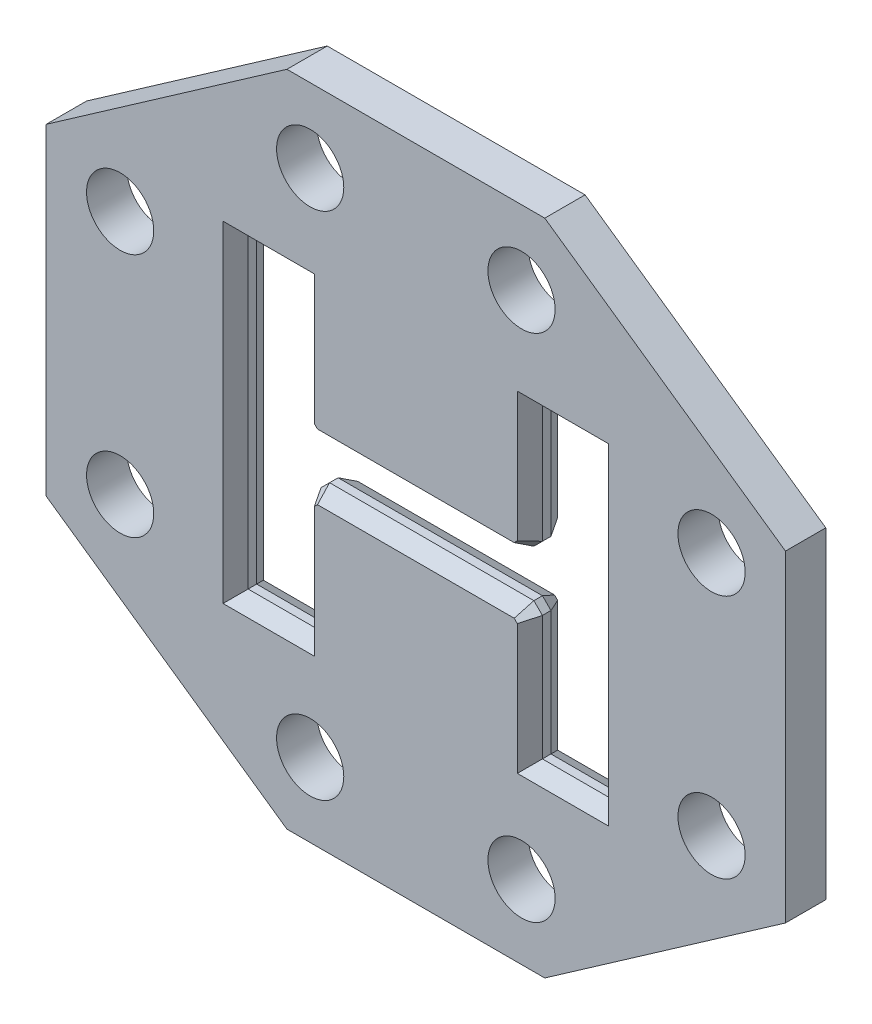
SolidWorks part; units mm, degrees
ref_plane "Front Plane" through (0, 0, 0) normal (1, 0, 0) x (0, 1, 0)
ref_plane "Top Plane" through (0, 0, 0) normal (0, 0, 1) x (0, 1, 0)
ref_plane "Right Plane" through (0, 0, 0) normal (0, 1, 0) x (-1, 0, 0)
sketch "sk W14x730" plane through (0, 0, 0) normal (0, 0, 1) x (0, 1, 0)
  point P0 (0, -284.734)
  point P1 (-38.989, 0)
  line B0 (-227.203, -284.734) -> (-227.203, -160.02)
  line B1 (-227.203, -160.02) -> (-54.229, -160.02)
  line B2 (-38.989, -144.78) -> (-38.989, 144.78)
  line B3 (-54.229, 160.02) -> (-227.203, 160.02)
  line B4 (-227.203, 160.02) -> (-227.203, 284.734)
  line B5 (-227.203, 284.734) -> (227.203, 284.734)
  line B6 (227.203, 284.734) -> (227.203, 160.02)
  line B7 (227.203, 160.02) -> (54.229, 160.02)
  line B8 (38.989, 144.78) -> (38.989, -144.78)
  line B9 (54.229, -160.02) -> (227.203, -160.02)
  line B10 (227.203, -160.02) -> (227.203, -284.734)
  line B11 (227.203, -284.734) -> (-227.203, -284.734)
  arc B12 (-54.229, -160.02) -> (-38.989, -144.78) centre (-54.229, -144.78) ccw
  arc B13 (-38.989, 144.78) -> (-54.229, 160.02) centre (-54.229, 144.78) ccw
  arc B14 (54.229, 160.02) -> (38.989, 144.78) centre (54.229, 144.78) ccw
  arc B15 (38.989, -144.78) -> (54.229, -160.02) centre (54.229, -144.78) ccw
sketch_block_instance "W14x730-113"
sketch_block "W14x730" parameters "D4"=15.24, "D1"=454.406, "D2"=569.468, "D3"=77.978, "D5"=124.714
sketch_block_instance "W14x730-232"
sketch_block_instance "W14x730-233"
sketch_block_instance "W14x730-234"
sketch_block_instance "W14x730-276"
sketch_block_instance "W14x730-277"
sketch_block_instance "W14x730-278"
sketch_block_instance "W14x730-279"
sketch_block_instance "W14x730-280"
sketch_block_instance "W14x730-281"
sketch_block_instance "W14x730-282"
sketch_block_instance "W14x730-283"
sketch_block_instance "W14x730-284"
sketch_block_instance "W14x730-285"
sketch_block_instance "W14x730-286"
sketch_block_instance "W14x730-287"
sketch_block_instance "W14x730-288"
sketch_block_instance "W14x730-289"
sketch_block_instance "W14x730-321"
sketch_block_instance "W14x730-322"
sketch_block_instance "W14x730-323"
sketch_block_instance "W14x730-324"
sketch_block_instance "W14x730-325"
sketch_block_instance "W14x730-326"
sketch_block_instance "W14x730-327"
sketch_block_instance "W14x730-328"
sketch_block_instance "W14x730-329"
sketch_block_instance "W14x730-330"
sketch_block_instance "W14x730-331"
sketch_block_instance "W14x730-332"
sketch_block_instance "W14x730-333"
sketch_block_instance "W14x730-334"
sketch_block_instance "W14x730-335"
sketch_block_instance "W14x730-336"
sketch_block_instance "W14x730-337"
sketch_block_instance "W14x730-338"
sketch_block_instance "W14x730-339"
sketch_block_instance "W14x730-340"
sketch_block_instance "W14x730-341"
sketch_block_instance "W14x730-365"
sketch_block_instance "W14x730-366"
sketch_block_instance "W14x730-367"
sketch_block_instance "W14x730-368"
sketch_block_instance "W14x730-369"
sketch_block_instance "W14x730-370"
sketch_block_instance "W14x730-371"
sketch_block_instance "W14x730-372"
sketch_block_instance "W14x730-373"
sketch_block_instance "W14x730-374"
sketch_block_instance "W14x730-375"
sketch_block_instance "W14x730-376"
sketch_block_instance "W14x730-377"
sketch_block_instance "W14x730-378"
sketch_block_instance "W14x730-379"
sketch_block_instance "W14x730-380"
sketch_block_instance "W14x730-381"
sketch_block_instance "W14x730-382"
sketch_block_instance "W14x730-383"
sketch_block_instance "W14x730-384"
sketch_block_instance "W14x730-385"
sketch_block_instance "W14x730-386"
sketch_block_instance "W14x730-387"
sketch_block_instance "W14x730-388"
sketch_block_instance "W14x730-389"
sketch_block_instance "W14x730-390"
sketch_block_instance "W14x730-391"
sketch_block_instance "W14x730-410"
sketch_block_instance "W14x730-411"
sketch_block_instance "W14x730-412"
sketch_block_instance "W14x730-413"
sketch_block_instance "W14x730-414"
sketch_block_instance "W14x730-415"
sketch_block_instance "W14x730-416"
sketch_block_instance "W14x730-417"
sketch_block_instance "W14x730-418"
sketch_block_instance "W14x730-419"
sketch_block_instance "W14x730-420"
sketch_block_instance "W14x730-421"
sketch_block_instance "W14x730-422"
sketch_block_instance "W14x730-423"
sketch_block_instance "W14x730-424"
sketch_block_instance "W14x730-425"
sketch_block_instance "W14x730-426"
sketch_block_instance "W14x730-427"
sketch_block_instance "W14x730-428"
sketch_block_instance "W14x730-429"
sketch_block_instance "W14x730-430"
sketch_block_instance "W14x730-431"
sketch_block_instance "W14x730-432"
sketch_block_instance "W14x730-433"
sketch_block_instance "W14x730-434"
sketch_block_instance "W14x730-435"
sketch_block_instance "W14x730-436"
sketch_block_instance "W14x730-437"
sketch_block_instance "W14x730-438"
sketch_block_instance "W14x730-439"
sketch_block_instance "W14x730-440"
sketch_block_instance "W14x730-443"
sketch_block_instance "W14x730-454"
sketch_block_instance "W14x730-455"
sketch_block_instance "W14x730-456"
sketch_block_instance "W14x730-457"
sketch_block_instance "W14x730-458"
sketch_block_instance "W14x730-459"
sketch_block_instance "W14x730-460"
sketch_block_instance "W14x730-461"
sketch_block_instance "W14x730-462"
sketch_block_instance "W14x730-463"
sketch_block_instance "W14x730-464"
sketch_block_instance "W14x730-465"
sketch_block_instance "W14x730-466"
sketch_block_instance "W14x730-467"
sketch_block_instance "W14x730-468"
sketch_block_instance "W14x730-469"
sketch_block_instance "W14x730-470"
sketch_block_instance "W14x730-471"
sketch_block_instance "W14x730-472"
sketch_block_instance "W14x730-473"
sketch_block_instance "W14x730-474"
sketch_block_instance "W14x730-475"
sketch_block_instance "W14x730-476"
sketch_block_instance "W14x730-477"
sketch_block_instance "W14x730-478"
sketch_block_instance "W14x730-479"
sketch_block_instance "W14x730-480"
sketch_block_instance "W14x730-481"
sketch_block_instance "W14x730-482"
sketch_block_instance "W14x730-483"
sketch_block_instance "W14x730-484"
sketch_block_instance "W14x730-485"
sketch_block_instance "W14x730-486"
sketch_block_instance "W14x730-487"
sketch_block_instance "W14x730-488"
sketch_block_instance "W14x730-489"
sketch_block_instance "W14x730-490" parameters "D1"=817.9177, "D2"=1027.7361, "D3"=0.4058, "D4"=24.0009, "D5"=0.4058, "D6"=533.4, "D7"=27.3509, "D8"=8374.3758, "D9"=3499.6788, "D10"=18059.4
sketch "sk W14x665" plane through (0, 0, 0) normal (0, 0, 1) x (0, 1, 0)
  point P0 (-224.155, -274.828)
  line B0 (-224.155, -274.828) -> (-224.155, -160.02)
  line B1 (-224.155, -160.02) -> (-51.181, -160.02)
  line B2 (-35.941, -144.78) -> (-35.941, 144.78)
  line B3 (-51.181, 160.02) -> (-224.155, 160.02)
  line B4 (-224.155, 160.02) -> (-224.155, 274.828)
  line B5 (-224.155, 274.828) -> (224.155, 274.828)
  line B6 (224.155, 274.828) -> (224.155, 160.02)
  line B7 (224.155, 160.02) -> (51.181, 160.02)
  line B8 (35.941, 144.78) -> (35.941, -144.78)
  line B9 (51.181, -160.02) -> (224.155, -160.02)
  line B10 (224.155, -160.02) -> (224.155, -274.828)
  line B11 (224.155, -274.828) -> (-224.155, -274.828)
  arc B12 (-51.181, -160.02) -> (-35.941, -144.78) centre (-51.181, -144.78) ccw
  arc B13 (-35.941, 144.78) -> (-51.181, 160.02) centre (-51.181, 144.78) ccw
  arc B14 (51.181, 160.02) -> (35.941, 144.78) centre (51.181, 144.78) ccw
  arc B15 (35.941, -144.78) -> (51.181, -160.02) centre (51.181, -144.78) ccw
sketch_block_instance "W14x665-1"
sketch_block "W14x665" parameters "D4"=15.24, "D1"=448.31, "D2"=549.656, "D3"=71.882, "D5"=114.808, "D6"=6.35
sketch "sk 605" plane through (0, 0, 0) normal (0, 0, 1) x (0, 1, 0)
  point P0 (-221.1705, -265.684)
  line B0 (-221.1705, -265.684) -> (-221.1705, -160.02)
  line B1 (-221.1705, -160.02) -> (-48.1965, -160.02)
  line B2 (-32.9565, -144.78) -> (-32.9565, 144.78)
  line B3 (-48.1965, 160.02) -> (-221.1705, 160.02)
  line B4 (-221.1705, 160.02) -> (-221.1705, 265.684)
  line B5 (-221.1705, 265.684) -> (221.1705, 265.684)
  line B6 (221.1705, 265.684) -> (221.1705, 160.02)
  line B7 (221.1705, 160.02) -> (48.1965, 160.02)
  line B8 (32.9565, 144.78) -> (32.9565, -144.78)
  line B9 (48.1965, -160.02) -> (221.1705, -160.02)
  line B10 (221.1705, -160.02) -> (221.1705, -265.684)
  line B11 (221.1705, -265.684) -> (-221.1705, -265.684)
  arc B12 (-48.1965, -160.02) -> (-32.9565, -144.78) centre (-48.1965, -144.78) ccw
  arc B13 (-32.9565, 144.78) -> (-48.1965, 160.02) centre (-48.1965, 144.78) ccw
  arc B14 (48.1965, 160.02) -> (32.9565, 144.78) centre (48.1965, 144.78) ccw
  arc B15 (32.9565, -144.78) -> (48.1965, -160.02) centre (48.1965, -144.78) ccw
sketch_block_instance "w14x605-2"
sketch_block "w14x605" parameters "D4"=15.24, "D1"=442.341, "D2"=531.368, "D3"=65.913, "D5"=105.664, "D6"=6.35
sketch "sk 550" plane through (0, 0, 0) normal (0, 0, 1) x (0, 1, 0)
  point P0 (-218.44, -257.048)
  point P1 (0, -257.048)
  point P2 (-30.226, 0)
  line B0 (-218.44, -257.048) -> (-218.44, -160.02)
  line B1 (-218.44, -160.02) -> (-45.466, -160.02)
  line B2 (-30.226, -144.78) -> (-30.226, 144.78)
  line B3 (-45.466, 160.02) -> (-218.44, 160.02)
  line B4 (-218.44, 160.02) -> (-218.44, 257.048)
  line B5 (-218.44, 257.048) -> (218.44, 257.048)
  line B6 (218.44, 257.048) -> (218.44, 160.02)
  line B7 (218.44, 160.02) -> (45.466, 160.02)
  line B8 (30.226, 144.78) -> (30.226, -144.78)
  line B9 (45.466, -160.02) -> (218.44, -160.02)
  line B10 (218.44, -160.02) -> (218.44, -257.048)
  line B11 (218.44, -257.048) -> (-218.44, -257.048)
  arc B12 (-45.466, -160.02) -> (-30.226, -144.78) centre (-45.466, -144.78) ccw
  arc B13 (-30.226, 144.78) -> (-45.466, 160.02) centre (-45.466, 144.78) ccw
  arc B14 (45.466, 160.02) -> (30.226, 144.78) centre (45.466, 144.78) ccw
  arc B15 (30.226, -144.78) -> (45.466, -160.02) centre (45.466, -144.78) ccw
sketch_block_instance "w14x550-1"
sketch_block "w14x550" parameters "D4"=15.24, "D1"=436.88, "D2"=514.096, "D3"=60.452, "D5"=97.028, "D6"=6.35
sketch "sk 4\" hex nut Pattern" plane through (0, 0, 0) normal (0, 0, 1) x (0, 1, 0)
  line L7 (419.0803, -173.5887) -> (419.0803, 173.5887)
  line L8 (419.0803, 173.5887) -> (173.5887, 419.0803)
  line L9 (173.5887, 419.0803) -> (-173.5887, 419.0803)
  line L10 (-173.5887, 419.0803) -> (-419.0803, 173.5887)
  line L11 (-419.0803, 173.5887) -> (-419.0803, -173.5887)
  line L12 (-419.0803, -173.5887) -> (-173.5887, -419.0803)
  line L13 (-173.5887, -419.0803) -> (173.5887, -419.0803)
  line L14 (173.5887, -419.0803) -> (419.0803, -173.5887)
  line L29 (54.229, -125.02) -> (262.203, -125.02)
  line L30 (262.203, -125.02) -> (262.203, -319.734)
  line L31 (-262.203, -125.02) -> (-54.229, -125.02)
  line L32 (-262.203, -319.734) -> (-262.203, -125.02)
  line L33 (262.203, -319.734) -> (-262.203, -319.734)
  line L34 (54.229, -125.02) -> (262.203, -125.02)
  line L35 (262.203, -125.02) -> (262.203, -319.734)
  line L36 (-262.203, -125.02) -> (-54.229, -125.02)
  line L37 (-262.203, -319.734) -> (-262.203, -125.02)
  line L38 (262.203, -319.734) -> (-262.203, -319.734)
  line L39 (-419.0803, 173.5887) -> (419.0803, -173.5887)
  line L40 (419.0803, 173.5887) -> (-419.0803, -173.5887)
  line L42 (-466.3243, 523.8553) -> (466.3243, 523.8553)
  line L43 (-466.3243, 523.8553) -> (-466.3243, -523.8553)
  line L44 (262.203, 125.02) -> (54.229, 125.02)
  line L45 (262.203, 319.734) -> (262.203, 125.02)
  line L46 (-262.203, 319.734) -> (262.203, 319.734)
  line L47 (-262.203, 125.02) -> (-262.203, 319.734)
  line L48 (-54.229, 125.02) -> (-262.203, 125.02)
  line L49 (262.203, 125.02) -> (54.229, 125.02)
  line L50 (262.203, 319.734) -> (262.203, 125.02)
  line L51 (-262.203, 319.734) -> (262.203, 319.734)
  line L52 (-262.203, 125.02) -> (-262.203, 319.734)
  line L53 (-54.229, 125.02) -> (-262.203, 125.02)
  line L54 (-466.3243, -523.8553) -> (466.3243, -523.8553)
  line L55 (466.3243, 523.8553) -> (466.3243, -523.8553)
  circle A0 centre (0, 0) radius 419.0803 construction
  line B0 (-128.6781, -496.8678) -> (-83.7675, -419.0803)
  circle B1 centre (-173.5887, -419.0803) radius 77.7875 construction
  circle B2 centre (-173.5887, -419.0803) radius 50.8
  circle B3 centre (-173.5887, -419.0803) radius 89.8213
  circle B4 centre (-173.5887, -419.0803) radius 99.3463
  line B5 (-83.7675, 419.0803) -> (-128.6781, 496.8678)
  line B6 (-128.6781, 496.8678) -> (-218.4994, 496.8678)
  line B7 (-218.4994, 496.8678) -> (-263.41, 419.0803)
  line B8 (-263.41, 419.0803) -> (-218.4994, 341.2928)
  line B9 (-218.4994, 341.2928) -> (-128.6781, 341.2928)
  circle B10 centre (-173.5887, 419.0803) radius 77.7875 construction
  circle B11 centre (-173.5887, 419.0803) radius 50.8
  circle B12 centre (-173.5887, 419.0803) radius 89.8213
  circle B13 centre (-173.5887, 419.0803) radius 99.3463
  line B14 (263.41, 419.0803) -> (218.4994, 496.8678)
  line B15 (218.4994, 496.8678) -> (128.6781, 496.8678)
  line B16 (128.6781, 496.8678) -> (83.7675, 419.0803)
  line B17 (128.6781, 341.2928) -> (218.4994, 341.2928)
  line B18 (218.4994, 341.2928) -> (263.41, 419.0803)
  circle B19 centre (173.5887, 419.0803) radius 50.8
  circle B20 centre (173.5887, 419.0803) radius 89.8213
  circle B21 centre (173.5887, 419.0803) radius 99.3463
  line B22 (263.41, -419.0803) -> (218.4994, -341.2928)
  line B23 (218.4994, -341.2928) -> (128.6781, -341.2928)
  line B24 (83.7675, -419.0803) -> (128.6781, -496.8678)
  line B25 (128.6781, -496.8678) -> (218.4994, -496.8678)
  line B26 (218.4994, -496.8678) -> (263.41, -419.0803)
  circle B27 centre (173.5887, -419.0803) radius 77.7875 construction
  circle B28 centre (173.5887, -419.0803) radius 50.8
  circle B29 centre (173.5887, -419.0803) radius 89.8213
  circle B30 centre (173.5887, -419.0803) radius 99.3463
  line B31 (-271.728, 149.7586) -> (-316.6386, 227.5461)
  line B32 (-316.6386, 227.5461) -> (-406.4599, 227.5461)
  line B33 (-406.4599, 227.5461) -> (-451.3705, 149.7586)
  line B34 (-451.3705, 149.7586) -> (-406.4599, 71.9711)
  line B35 (-406.4599, 71.9711) -> (-316.6386, 71.9711)
  circle B36 centre (-361.5493, 149.7586) radius 77.7875 construction
  circle B37 centre (-361.5493, 149.7586) radius 50.8
  circle B38 centre (-361.5493, 149.7586) radius 89.8213
  circle B39 centre (-361.5493, 149.7586) radius 99.3463
  line B40 (-271.728, -149.7586) -> (-316.6386, -71.9711)
  line B41 (-316.6386, -71.9711) -> (-406.4599, -71.9711)
  line B42 (-406.4599, -71.9711) -> (-451.3705, -149.7586)
  line B43 (-451.3705, -149.7586) -> (-406.4599, -227.5461)
  line B44 (-406.4599, -227.5461) -> (-316.6386, -227.5461)
  line B45 (-316.6386, -227.5461) -> (-271.728, -149.7586)
  circle B46 centre (-361.5493, -149.7586) radius 77.7875 construction
  circle B47 centre (-361.5493, -149.7586) radius 50.8
  circle B48 centre (-361.5493, -149.7586) radius 89.8213
  circle B49 centre (-361.5493, -149.7586) radius 99.3463
  line B50 (451.3705, 149.7586) -> (406.4599, 227.5461)
  line B51 (406.4599, 227.5461) -> (316.6386, 227.5461)
  line B52 (316.6386, 227.5461) -> (271.728, 149.7586)
  line B53 (316.6386, 71.9711) -> (406.4599, 71.9711)
  circle B54 centre (361.5493, 149.7586) radius 77.7875 construction
  circle B55 centre (361.5493, 149.7586) radius 50.8
  circle B56 centre (361.5493, 149.7586) radius 89.8213
  circle B57 centre (361.5493, 149.7586) radius 99.3463
  line B58 (316.6386, -71.9711) -> (271.728, -149.7586)
  line B59 (406.4599, -227.5461) -> (451.3705, -149.7586)
  circle B60 centre (361.5493, -149.7586) radius 77.7875 construction
  circle B61 centre (361.5493, -149.7586) radius 50.8
  circle B62 centre (361.5493, -149.7586) radius 89.8213
  circle B63 centre (361.5493, -149.7586) radius 99.3463
sketch_block_instance "4\" hex nut-1"
sketch_block "4\" hex nut" parameters "D1"=155.575, "D2"=101.6, "D3"=9.525
sketch_block_instance "4\" hex nut-2"
sketch_block_instance "4\" hex nut-3"
sketch_block_instance "4\" hex nut-4"
sketch_block_instance "4\" hex nut-5"
sketch_block_instance "4\" hex nut-6"
sketch_block_instance "4\" hex nut-7"
sketch_block_instance "4\" hex nut-8" parameters "D1"=129.9071, "D2"=77.383, "D3"=138.8929, "D4"=187.7059, "D5"=195.0068, "D6"=231.3326
sketch "Sketch3" plane through (0, 0, 0) normal (0, 0, 1) x (0, 1, 0)
  line L0 (-466.3243, 523.8553) -> (466.3243, 523.8553) construction
  line L1 (466.3243, 523.8553) -> (466.3243, -523.8553) construction
  line L2 (-466.3243, -523.8553) -> (466.3243, -523.8553) construction
  line L3 (-466.3243, 523.8553) -> (-466.3243, -523.8553) construction
  line L4 (228.2342, 523.8553) -> (466.3243, 182.7049)
  line L5 (466.3243, 182.7049) -> (466.3243, -182.7049)
  line L6 (466.3243, -182.7049) -> (228.2342, -523.8553)
  line L7 (228.2342, -523.8553) -> (-228.2342, -523.8553)
  line L8 (-228.2342, -523.8553) -> (-466.3243, -182.7049)
  line L9 (-466.3243, -182.7049) -> (-466.3243, 182.7049)
  line L10 (-466.3243, 182.7049) -> (-228.2342, 523.8553)
  line L11 (-228.2342, 523.8553) -> (228.2342, 523.8553)
  line L93 (-54.229, 156.845) -> (-230.378, 156.845)
  line L94 (-230.378, 156.845) -> (-230.378, 287.909)
  line L95 (230.378, 156.845) -> (54.229, 156.845)
  line L96 (230.378, 287.909) -> (230.378, 156.845)
  line L97 (-230.378, 287.909) -> (230.378, 287.909)
  line L98 (-54.229, 156.845) -> (-230.378, 156.845)
  line L99 (-230.378, 156.845) -> (-230.378, 287.909)
  line L100 (230.378, 156.845) -> (54.229, 156.845)
  line L101 (230.378, 287.909) -> (230.378, 156.845)
  line L102 (-230.378, 287.909) -> (230.378, 287.909)
  line L118 (54.229, -156.845) -> (230.378, -156.845)
  line L119 (230.378, -156.845) -> (230.378, -287.909)
  line L120 (230.378, -287.909) -> (-230.378, -287.909)
  line L121 (-230.378, -287.909) -> (-230.378, -156.845)
  line L122 (-230.378, -156.845) -> (-54.229, -156.845)
  line L123 (54.229, -156.845) -> (230.378, -156.845)
  line L124 (230.378, -156.845) -> (230.378, -287.909)
  line L125 (230.378, -287.909) -> (-230.378, -287.909)
  line L126 (-230.378, -287.909) -> (-230.378, -156.845)
  line L127 (-230.378, -156.845) -> (-54.229, -156.845)
  line L130 (42.164, 144.78) -> (42.164, -144.78)
  line L131 (42.164, 144.78) -> (42.164, -144.78)
  line L132 (-54.229, 156.845) -> (-42.164, 144.78)
  line L133 (-42.164, -144.78) -> (-42.164, 144.78)
  line L134 (-42.164, -144.78) -> (-42.164, 144.78)
  line L135 (42.164, 144.78) -> (54.229, 156.845)
  line L136 (42.164, -144.78) -> (54.229, -156.845)
  line L137 (-54.229, -156.845) -> (-42.164, -144.78)
  circle A0 centre (173.5887, 419.0803) radius 104.775 construction
  circle A1 centre (-173.5887, 419.0803) radius 104.775 construction
  circle A2 centre (-361.5493, 149.7586) radius 104.775 construction
  circle A3 centre (-361.5493, -149.7586) radius 104.775 construction
  circle A4 centre (-173.5887, -419.0803) radius 104.775 construction
  circle A5 centre (173.5887, -419.0803) radius 104.775 construction
  circle A6 centre (361.5493, -149.7586) radius 104.775 construction
  circle A7 centre (361.5493, 149.7586) radius 104.775 construction
  dimension "D1" = 3.175
  dimension "D2" = 3.175
  dimension "D3" = 3.175
  dimension "D4" = 3.175
extrude "Main Plate" add sketch "Sketch3" along normal mid plane 57.15
sketch "Sketch7" plane through (0, 0, 0) normal (0, 0, 1) x (0, 1, 0)
  line L0 (-45.466, 156.845) -> (-33.401, 144.78)
  line L1 (33.401, 144.78) -> (45.466, 156.845)
  line L2 (-45.466, -156.845) -> (-33.401, -144.78)
  line L3 (33.401, -144.78) -> (45.466, -156.845)
  line L10 (221.615, 260.223) -> (221.615, 156.845)
  line L11 (221.615, 156.845) -> (45.466, 156.845)
  line L12 (-221.615, 260.223) -> (221.615, 260.223)
  line L23 (-221.615, 156.845) -> (-221.615, 260.223)
  line L24 (-45.466, 156.845) -> (-221.615, 156.845)
  line L25 (221.615, 260.223) -> (221.615, 156.845)
  line L26 (221.615, 156.845) -> (45.466, 156.845)
  line L32 (-221.615, 260.223) -> (221.615, 260.223)
  line L45 (-221.615, 156.845) -> (-221.615, 260.223)
  line L46 (-45.466, 156.845) -> (-221.615, 156.845)
  line L61 (-242.3311, 298.7357) -> (246.0967, 298.7357)
  line L62 (-242.3311, 298.7357) -> (-242.3311, -298.6887)
  line L63 (-242.3311, -298.6887) -> (246.0967, -298.6887)
  line L64 (246.0967, 298.7357) -> (246.0967, -298.6887)
  line L74 (33.401, 144.78) -> (33.401, -144.78)
  line L75 (33.401, 144.78) -> (33.401, -144.78)
  line L77 (221.615, -156.845) -> (221.615, -260.223)
  line L78 (45.466, -156.845) -> (221.615, -156.845)
  line L79 (221.615, -260.223) -> (-221.615, -260.223)
  line L80 (-221.615, -260.223) -> (-221.615, -156.845)
  line L81 (-221.615, -156.845) -> (-45.466, -156.845)
  line L82 (221.615, -156.845) -> (221.615, -260.223)
  line L83 (45.466, -156.845) -> (221.615, -156.845)
  line L84 (221.615, -260.223) -> (-221.615, -260.223)
  line L85 (-221.615, -260.223) -> (-221.615, -156.845)
  line L86 (-221.615, -156.845) -> (-45.466, -156.845)
  line L87 (-33.401, -144.78) -> (-33.401, 144.78)
  line L88 (-33.401, -144.78) -> (-33.401, 144.78)
  dimension "D1" = 3.175
  dimension "D2" = 3.175
  dimension "D3" = 3.175
  dimension "D4" = 3.175
extrude "W550" add sketch "Sketch7" along normal mid plane 57.15
sketch "Sketch5" plane through (0, 0, 0) normal (0, 0, 1) x (0, 1, 0)
  circle A0 centre (-173.5887, 419.0803) radius 47.625
  circle A1 centre (173.5887, 419.0803) radius 47.625
  circle A2 centre (361.5493, 149.7586) radius 47.625
  circle A3 centre (361.5493, -149.7586) radius 47.625
  circle A4 centre (173.5887, -419.0803) radius 47.625
  circle A5 centre (-173.5887, -419.0803) radius 47.625
  circle A6 centre (-361.5493, -149.7586) radius 47.625
  circle A7 centre (-361.5493, 149.7586) radius 47.625
  dimension "D1" = 95.25
  dimension "D2" = 95.25
  dimension "D3" = 95.25
  dimension "D4" = 95.25
  dimension "D5" = 95.25
  dimension "D6" = 95.25
  dimension "D7" = 95.25
  dimension "D8" = 95.25
extrude "holes" cut sketch "Sketch5" against normal through all both and the other way through all
chamfer "Chamfer1" distance 13 angle 60 16 edges at (156.845, -133.5405, 28.575) (156.845, 133.5405, 28.575) (-156.845, -133.5405, 28.575) (-156.845, 133.5405, 28.575) (208.534, -221.615, 28.575) (260.223, 0, 28.575) (208.534, 221.615, 28.575) (150.8125, 39.4335, 28.575) (0, 33.401, 28.575) (-150.8125, 39.4335, 28.575) (-208.534, 221.615, 28.575) (-260.223, 0, 28.575) (-208.534, -221.615, 28.575) (-150.8125, -39.4335, 28.575) (0, -33.401, 28.575) (150.8125, -39.4335, 28.575)
chamfer "Chamfer2" distance 13 angle 60 16 edges at (0, -33.401, -28.575) (-150.8125, -39.4335, -28.575) (-208.534, -221.615, -28.575) (-260.223, 0, -28.575) (-208.534, 221.615, -28.575) (-150.8125, 39.4335, -28.575) (0, 33.401, -28.575) (150.8125, 39.4335, -28.575) (208.534, 221.615, -28.575) (260.223, 0, -28.575) (208.534, -221.615, -28.575) (150.8125, -39.4335, -28.575) (156.845, 133.5405, -28.575) (156.845, -133.5405, -28.575) (-156.845, -133.5405, -28.575) (-156.845, 133.5405, -28.575)
